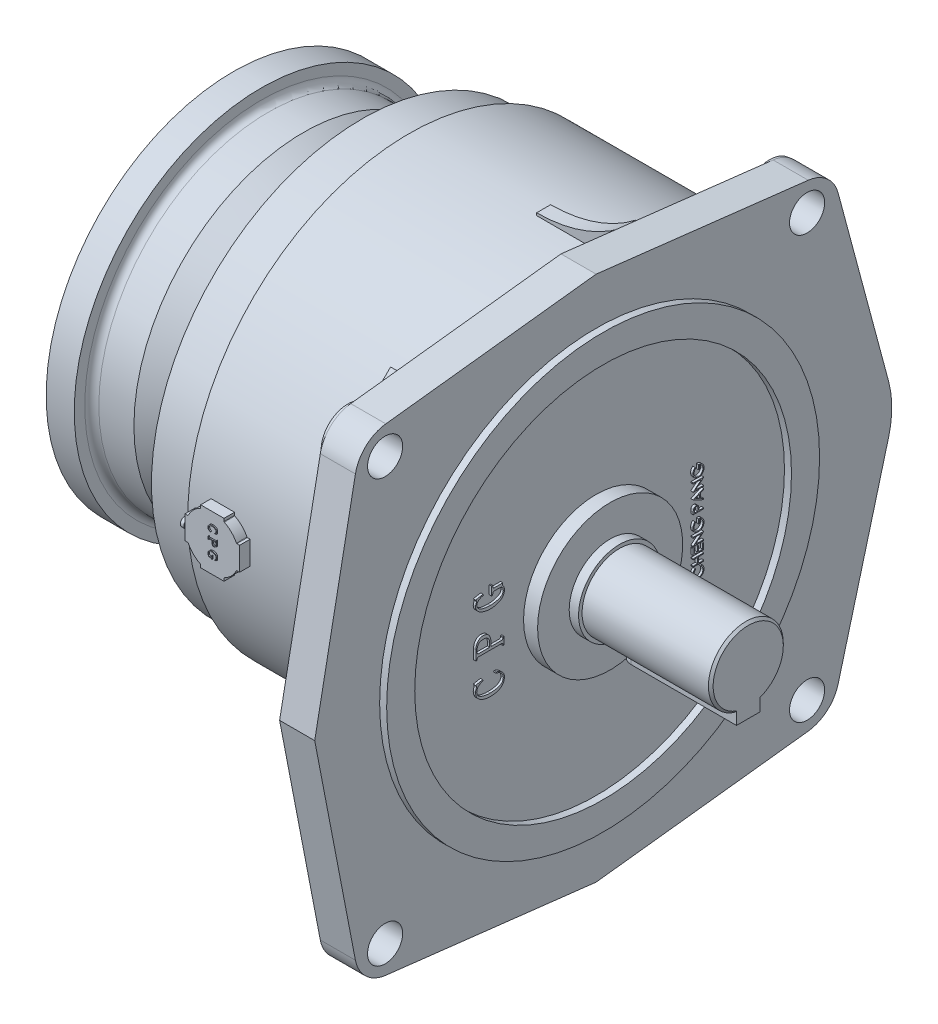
SolidWorks part; units mm, degrees
ref_plane "前视基准面" through (0, 0, 0) normal (0, 0, 1) x (1, 0, 0)
ref_plane "上视基准面" through (0, 0, 0) normal (0, 1, 0) x (1, 0, 0)
ref_plane "右视基准面" through (0, 0, 0) normal (1, 0, 0) x (0, 0, -1)
sketch "草图1" plane through (0, 0, 0) normal (0, 1, 0) x (1, 0, 0)
  line L0 (0, 0) -> (15.7361, 0) construction
  line L1 (0, 0) -> (0, -16)
  line L2 (0, -16) -> (-55, -16)
  line L3 (-55, -16) -> (-55, -17.5)
  line L4 (-55, -17.5) -> (-59, -17.5)
  line L5 (-62, -31) -> (-62, -92.5)
  line L6 (-62, -92.5) -> (-65, -92.5)
  line L7 (-65, -92.5) -> (-65, 0)
  line L8 (-65, 0) -> (0, 0)
  line L9 (-62, -31) -> (-59, -31)
  line L10 (-59, -31) -> (-59, -17.5)
  dimension "D1" = 55
  dimension "D2" = 32
  dimension "D3" = 35
  dimension "D4" = 3
  dimension "D5" = 185
  dimension "D6" = 65
  dimension "D7" = 3
  dimension "D8" = 62
revolve "旋转1" add sketch "草图1" angle 360 about L0
sketch "草图2" plane through (0, 0, 0) normal (0, 1, 0) x (1, 0, 0)
  line L0 (8.0167, 30) -> (-80, 30) construction
  line L1 (-65, 92.5) -> (-65, -92.5) construction
  line L4 (-80, 30) -> (-80, -64.5)
  line L5 (-80, -64.5) -> (-175, -64.5)
  line L6 (-175, -64.5) -> (-175, 30)
  line L11 (-80, 30) -> (-175, 30)
  dimension "D1" = 30
  dimension "D2" = 15
  dimension "D3" = 189
  dimension "D5" = 95
revolve "旋转2" add sketch "草图2" angle 360 about L0
sketch "草图12" plane through (-80, 0, 0) normal (1, 0, 0) x (0, 0, -1)
  line L0 (0, -112.5) -> (100.7627, -100.7627)
  line L1 (-100.7627, -100.7627) -> (0, -112.5)
  line L2 (-100.7627, -100.7627) -> (-120.238, 0)
  line L3 (-100.7627, 100.7627) -> (0, 112.5)
  line L4 (100.7627, -100.7627) -> (127.762, 0)
  line L5 (-120.238, 0) -> (-100.7627, 100.7627)
  line L6 (0, 112.5) -> (100.7627, 100.7627)
  line L7 (127.762, 0) -> (100.7627, 100.7627)
  line L8 (167.8979, 0) -> (-107.2143, 0) construction
  line L9 (0, 107.5085) -> (0, -103.3164) construction
  line L10 (0, 0) -> (-90.1561, 90.1561) construction
  line L11 (0, 0) -> (90.1561, 90.1561) construction
  circle A0 centre (0, 0) radius 127.5 construction
  circle A1 centre (-90.1561, 90.1561) radius 7.5
  circle A2 centre (90.1561, 90.1561) radius 7.5
  circle A3 centre (90.1561, -90.1561) radius 7.5
  circle A4 centre (-90.1561, -90.1561) radius 7.5
  dimension "D3" = 255
  dimension "D4" = 15
  dimension "D5" = 15
  dimension "D1" = 225
  dimension "D2" = 248
  dimension "D6" = 15
extrude "拉伸8" add sketch "草图12" along normal up to surface (15 mm away)
sketch "草图5" plane through (0, 0, 0) normal (0, 1, 0) x (1, 0, 0)
  line L0 (0, -5) -> (-45, -5)
  line L1 (0, -16) -> (0, 16) construction
  line L2 (-45, 5) -> (0, 5)
  line L3 (0, 5) -> (0, -5)
  line L4 (35.5, -13.7955) -> (35.5, 19.6443) construction
  arc A0 (-45, -5) -> (-45, 5) centre (-45, 0) cw
  dimension "D2" = 50
  dimension "D1" = 10
  dimension "D3" = 35.5
extrude "拉伸4" add sketch "草图5" against normal blind 19.5
fillet "圆角4" radius 15 4 edges at (-72.5, 100.7627, 100.7627) (-72.5, 100.7627, -100.7627) (-72.5, -100.7627, -100.7627) (-72.5, -100.7627, 100.7627)
fillet "圆角5" radius 40 1 edges at (-72.5, 0, -127.762)
chamfer "倒角1" distance 1 angle 45 1 edges at (0, 16, 0)
sketch "草图18" plane through (-80, 0, 0) normal (-1, 0, 0) x (0, 0, 1)
  line L0 (-30, 0) -> (73.8927, -103.8927) construction
  line L1 (0, -96.25) -> (0, 96.25) construction
  line L2 (89.8548, -102.0333) -> (0, -112.5) construction
  line L3 (36.8216, -66.8216) -> (73.8927, -103.8927)
  line L4 (-30, 0) -> (-90.1561, -90.1561) construction
  line L5 (-88.91, -87.0419) -> (-82.4506, -78.6078)
  line L7 (-30, 0) -> (-30, -109.0055) construction
  line L8 (0, -112.5) -> (-90.6456, -101.9412) construction
  line L9 (-30, -94.5) -> (-30, -109.0055)
  circle A0 centre (-30, 0) radius 94.5 construction
  arc A1 (-103.3989, -90.9242) -> (-90.6456, -101.9412) centre (-88.91, -87.0419) ccw construction
  circle A3 centre (-30, 0) radius 94.5 construction
  dimension "D1" = 45
  dimension "D2" = 10.6235
  dimension "D4" = 52.4264
  dimension "D5" = 14.5055
ref_plane "基准面7" through (-81, 0, 0) normal (1, 0, 0) x (0, 0, -1)
sketch "草图13" plane through (-80, 0, 0) normal (1, 0, 0) x (0, 0, -1)
  line L5 (0, 0) -> (107.7406, 0) construction
  circle A1 centre (90.1561, 90.1561) radius 11.6458
  circle A3 centre (90.1561, 90.1561) radius 7.5
  circle A4 centre (90.1561, -90.1561) radius 7.5 construction
  circle A5 centre (90.1561, -90.1561) radius 7.5
  circle A7 centre (-90.1561, -90.1561) radius 7.5
  arc A10 (90.6456, -101.9412) -> (103.3989, -90.9242) centre (88.91, -87.0419) ccw construction
  circle A11 centre (-90.1561, -90.1561) radius 7.5 construction
  arc A12 (-102.8467, -89.9806) -> (-89.8548, -102.0333) centre (-88.1192, -87.1341) ccw construction
  circle A14 centre (-90.1561, 90.1561) radius 7.5
  circle A15 centre (-90.1561, 90.1561) radius 11.3556
  circle A20 centre (-90.1561, -90.1561) radius 11.3556
  circle A21 centre (90.1561, -90.1561) radius 11.6458
  point P8 (30, 0)
extrude "拉伸9" add sketch "草图13" against normal up to surface (1 mm away)
sketch "草图14" plane through (0, 0, 0) normal (0, 1, 0) x (1, 0, 0)
  line L0 (-80, 30) -> (-175, 30) construction
  line L5 (-80, -89.8548) -> (-80, 0) construction
  line L6 (-117.4264, -64.5) -> (-117.4264, -65.5)
  line L7 (-80, -101.9264) -> (-81, -101.9264)
  line L9 (-80, -64.5) -> (-175, -64.5) construction
  arc A0 (-81, -101.9264) -> (-117.4264, -65.5) centre (-117.4264, -101.9264) ccw
  dimension "D1" = 131.9264
  dimension "D2" = 1
  dimension "D3" = 1
rib "筋17" sketch "草图14" sketch "草图14" thickness 6 extrusion direction parallel to sketch draft on no parameters "D1"=6
pattern_circular "阵列(圆周)16" count 8 over 360 about axis through (0, 0, -30) along (1, 0, 0) of "筋17"
ref_plane "基准面8" through (0, 0, -30) normal (0, 0, 1) x (1, 0, 0)
sketch "草图17" plane through (0, 0, -30) normal (0, 0, 1) x (1, 0, 0)
  line L0 (-80, -108.0055) -> (-81, -108.0055)
  line L1 (-80, -102.0333) -> (-80, -112.5) construction
  line L2 (-117.4264, -94.5) -> (-117.4264, -95.5)
  line L4 (-175, -94.5) -> (-80, -94.5) construction
  line L6 (-117.4264, -69.65) -> (-117.4264, -65.4074) construction
  arc A0 (-81, -108.0055) -> (-117.4264, -95.5) centre (-117.4264, -154.8049) ccw
  dimension "D1" = 13.5055
  dimension "D2" = 1
  dimension "D3" = 1
rib "筋24" sketch "草图17" sketch "草图17" thickness 6 extrusion direction parallel to sketch draft on no parameters "D1"=6
mirror "镜向1" about plane through (0, 0, 0) normal (0, 1, 0) of "筋24"
sketch "草圖1" plane through (0, 0, 0) normal (0, 1, 0) x (1, 0, 0)
  line L0 (-175, 30) -> (-242.5, 30)
  line L1 (-175, 124.5) -> (-175, -64.5) construction
  line L2 (-37.3334, 30) -> (-347.0809, 30) construction
  line L3 (-195, -60) -> (-195, -30)
  line L4 (-195, -30) -> (-200, -30)
  line L5 (-200, -30) -> (-220, -42.5)
  line L6 (-220, -42.5) -> (-235, -42.5)
  line L7 (-238, -45.5) -> (-238, -50)
  line L8 (-238, -50) -> (-250, -50)
  line L9 (-250, -50) -> (-250, -26)
  line L10 (-249, -25) -> (-246, -25)
  line L11 (-246, -25) -> (-246, -20.0871)
  line L12 (-225, -9.5606) -> (-225, -4)
  line L13 (-228, -1) -> (-243, -1)
  line L14 (-244, 0) -> (-244, 9)
  line L15 (-244, 9) -> (-242.8, 9)
  line L16 (-242.5, 9.3) -> (-242.5, 30)
  line L17 (-245.9137, -19.988) -> (-225, -17.0869)
  line L18 (-195, -60) -> (-175, -60)
  line L19 (-175, 30) -> (-175, -60)
  arc A0 (-235, -42.5) -> (-238, -45.5) centre (-235, -45.5) ccw
  arc A1 (-225, -17.0869) -> (-223.7461, -12.0001) centre (-225.3875, -14.2934) ccw
  arc A2 (-249, -25) -> (-250, -26) centre (-249, -26) ccw
  arc A3 (-245.9137, -19.988) -> (-246, -20.0871) centre (-245.9, -20.0871) ccw
  arc A4 (-223.7461, -12.0001) -> (-225, -9.5606) centre (-222, -9.5606) cw
  arc A5 (-225, -4) -> (-228, -1) centre (-228, -4) ccw
  arc A6 (-243, -1) -> (-244, 0) centre (-243, 0) cw
  arc A7 (-242.8, 9) -> (-242.5, 9.3) centre (-242.8, 9.3) ccw
  point P27 (-250, -25)
  point P30 (-246, -20)
  point P33 (-225, -11.5)
  point P38 (-244, -1)
  point P41 (-244, 10)
  dimension "D9" = 160
  dimension "D19" = 30
  dimension "D2" = 180
  dimension "D3" = 55
  dimension "D4" = 250
  dimension "D5" = 195
  dimension "D8" = 145
  dimension "D10" = 110
revolve "旋轉1" add sketch "草圖1" angle 360 about L2
sketch "草圖2" plane through (-250, 0, 0) normal (-1, 0, 0) x (0, 0, 1)
  line L0 (-114.0945, 0) -> (58.8288, 0) construction
  line L1 (-30, 84.2191) -> (-30, -84.9666) construction
  circle A0 centre (-30, 0) radius 65 construction
  circle A1 centre (-75.9619, 45.9619) radius 4
  circle A2 centre (15.9619, 45.9619) radius 4
  circle A3 centre (15.9619, -45.9619) radius 4
  circle A4 centre (-75.9619, -45.9619) radius 4
  dimension "D1" = 130
  dimension "D2" = 8
extrude "伸長1" cut sketch "草圖2" against normal blind 25
sketch "草圖3" plane through (-250, 0, 0) normal (-1, 0, 0) x (0, 0, 1)
  line L0 (-29.7357, 0.1095) -> (-95.9995, 0.1095) construction
  line L1 (-90.8691, 25.8875) -> (-71.1652, 5.6346)
  line L2 (-90.8691, -25.14) -> (-71.1013, -5.3652)
  line L3 (-70.1598, 10.8351) -> (-77.2309, 17.9061)
  line L4 (-47.5324, 47.6046) -> (-40.4613, 40.5336)
  line L5 (-76.4923, 35.1988) -> (-64.825, 46.866)
  line L6 (-55.5138, 61.2429) -> (-35.739, 41.475)
  line L7 (-4.4862, 61.2429) -> (-24.7392, 41.539)
  line L8 (4.825, 46.866) -> (16.4923, 35.1988)
  line L10 (17.2309, 17.9061) -> (10.1598, 10.8351)
  line L11 (30.8691, 25.8875) -> (11.1013, 6.1127)
  line L12 (30.8691, -25.14) -> (11.1652, -4.8871)
  line L13 (16.4923, -34.4513) -> (4.825, -46.1185)
  line L15 (-12.4676, -46.8571) -> (-19.5387, -39.7861)
  line L16 (-4.4862, -60.4954) -> (-24.261, -40.7275)
  line L17 (-55.5138, -60.4954) -> (-35.2608, -40.7914)
  line L18 (-64.825, -46.1185) -> (-76.4923, -34.4513)
  line L20 (-77.2309, -17.1586) -> (-70.1598, -10.0876)
  line L22 (-19.5387, 40.5336) -> (-12.4676, 47.6046)
  line L24 (10.1598, -10.0876) -> (17.2309, -17.1586)
  line L29 (-40.4613, -39.7861) -> (-47.5324, -46.8571)
  arc A0 (-90.8691, 25.8875) -> (-90.8691, -25.14) centre (-30, 0.3738) ccw
  arc A1 (-40.4613, 40.5336) -> (-70.1598, 10.8351) centre (-30, 0.3738) ccw
  arc A2 (10.1598, 10.8351) -> (-19.5387, 40.5336) centre (-30, 0.3738) ccw
  arc A3 (-71.1652, 5.6346) -> (-71.1013, -5.3652) centre (-30, 0.3738) ccw
  arc A4 (-4.4862, 61.2429) -> (-55.5138, 61.2429) centre (-30, 0.3738) ccw
  arc A5 (-24.7392, 41.539) -> (-35.739, 41.475) centre (-30, 0.3738) ccw
  arc A6 (-19.5387, -39.7861) -> (10.1598, -10.0876) centre (-30, 0.3738) ccw
  arc A7 (30.8691, -25.14) -> (30.8691, 25.8875) centre (-30, 0.3738) ccw
  arc A8 (11.1652, -4.8871) -> (11.1013, 6.1127) centre (-30, 0.3738) ccw
  arc A9 (-70.1598, -10.0876) -> (-40.4613, -39.7861) centre (-30, 0.3738) ccw
  arc A10 (-55.5138, -60.4954) -> (-4.4862, -60.4954) centre (-30, 0.3738) ccw
  arc A11 (-35.2608, -40.7914) -> (-24.261, -40.7275) centre (-30, 0.3738) ccw
  spline S0 degree 2 poles (-77.2309, 17.9061) (-82.0713, 26.7678) (-76.4923, 35.1988) knots 0 0 0 1 1 1
  spline S1 degree 2 poles (-47.5324, 47.6046) (-56.3941, 52.445) (-64.825, 46.866) knots 0 0 0 1 1 1
  spline S2 degree 2 poles (17.2309, 17.9061) (22.0713, 26.7678) (16.4923, 35.1988) knots 0 0 0 1 1 1
  spline S3 degree 2 poles (-12.4676, 47.6046) (-3.6059, 52.445) (4.825, 46.866) knots 0 0 0 1 1 1
  spline S4 degree 2 poles (-12.4676, -46.8571) (-3.6059, -51.6975) (4.825, -46.1185) knots 0 0 0 1 1 1
  spline S5 degree 2 poles (17.2309, -17.1586) (22.0713, -26.0203) (16.4923, -34.4513) knots 0 0 0 1 1 1
  spline S6 degree 2 poles (-77.2309, -17.1586) (-82.0713, -26.0203) (-76.4923, -34.4513) knots 0 0 0 1 1 1
  spline S7 degree 2 poles (-47.5324, -46.8571) (-56.3941, -51.6975) (-64.825, -46.1185) knots 0 0 0 1 1 1
extrude "伸長2" cut sketch "草圖3" against normal blind 39
sketch "草圖4" plane through (-211, 0, 0) normal (-1, 0, 0) x (0, 0, 1)
  circle A0 centre (-30, 0) radius 51.5 construction
  circle A1 centre (-66.416, 36.416) radius 3
  circle A2 centre (6.416, 36.416) radius 3
  circle A3 centre (6.416, -36.416) radius 3
  circle A4 centre (-66.416, -36.416) radius 3
  dimension "D1" = 103
  dimension "D2" = 6
extrude "伸長3" cut sketch "草圖4" against normal blind 11
sketch "草圖5" plane through (-242.5, 0, 0) normal (-1, 0, 0) x (0, 0, 1)
  line L0 (-46.5253, 0) -> (-14, 0) construction
  line L1 (-32.5, -9.3) -> (-27.5, -9.3)
  line L2 (-32.5, -9.3) -> (-32.5, -6.5383)
  line L3 (-30, 17.7414) -> (-30, -16.5842) construction
  line L4 (-27.5, -9.3) -> (-27.5, -6.5383)
  circle A0 centre (-30, 0) radius 12.5 construction
  arc A2 (-27.5, -6.5383) -> (-32.5, -6.5383) centre (-30, 0) ccw
  dimension "D1" = 25
  dimension "D2" = 5
  dimension "D5" = 14
  dimension "D4" = 9.3
extrude "伸長4" cut sketch "草圖5" against normal blind 28
sketch "草圖6" plane through (-242.5, 0, 0) normal (-1, 0, 0) x (0, 0, 1)
  line L0 (-32.5, -9.3) -> (-32.5, -6.5383) construction
  line L1 (-32.5, -9.3) -> (-27.5, -9.3) construction
  line L2 (-27.5, -9.3) -> (-27.5, -6.5383) construction
  line L3 (-32.5, -9.3) -> (-32.5, -6.5383)
  line L4 (-32.5, -9.3) -> (-27.5, -9.3)
  line L5 (-27.5, -9.3) -> (-27.5, -6.5383)
  arc A0 (-27.5, -6.5383) -> (-32.5, -6.5383) centre (-30, 0) ccw construction
  arc A1 (-27.5, -6.5383) -> (-32.5, -6.5383) centre (-30, 0) ccw
  circle A2 centre (-30, 0) radius 12.5 construction
  circle A3 centre (-30, 0) radius 12.5
extrude "伸長5" add sketch "草圖6" along normal blind 1
sketch "草圖7" plane through (-62, 0, 0) normal (1, 0, 0) x (0, 0, -1)
  circle A0 centre (0, 0) radius 80.5
  circle A1 centre (0, 0) radius 31 construction
  circle A2 centre (0, 0) radius 31
  dimension "D1" = 161
extrude "伸長6" cut sketch "草圖7" against normal blind 3
sketch "草圖8"
  dimension "D1" = 70
  dimension "D2" = 70
  dimension "D3" = 40
  dimension "D4" = 45
  dimension "D5" = 35
extrude "伸長7" add sketch "草圖8" along normal blind 1
ref_plane "平面1" through (0, 0, 69) normal (0, 0, 1) x (1, 0, 0)
sketch "草圖9" plane through (0, 0, 69) normal (0, 0, 1) x (1, 0, 0)
  line L0 (-165, 11.65) -> (-155, 11.65)
  line L1 (-165, 11.65) -> (-165, 10.5119)
  line L2 (-155, 11.65) -> (-155, 10.5119)
  line L3 (-165, -10.5119) -> (-165, -11.65)
  line L4 (-155, -10.5119) -> (-155, -11.65)
  line L5 (-171.65, 5) -> (-170.5119, 5)
  line L6 (-171.65, -5) -> (-170.5119, -5)
  line L7 (-171.65, -5) -> (-171.65, 5)
  line L8 (-165, -11.65) -> (-165, -10.5119)
  line L9 (-155, -11.65) -> (-155, -10.5119)
  line L10 (-155, -11.65) -> (-165, -11.65)
  line L11 (-148.35, -5) -> (-149.4881, -5)
  line L12 (-148.35, 5) -> (-149.4881, 5)
  line L13 (-148.35, 5) -> (-148.35, -5)
  arc A0 (-165.1383, 10.2882) -> (-170.2882, 5.1383) centre (-160, 0) ccw
  arc A1 (-165.1383, 10.2882) -> (-165, 10.5119) centre (-165.25, 10.5119) ccw
  arc A2 (-155, 10.5119) -> (-154.8617, 10.2882) centre (-154.75, 10.5119) ccw
  arc A3 (-170.5119, 5) -> (-170.2882, 5.1383) centre (-170.5119, 5.25) ccw
  arc A4 (-170.2882, -5.1383) -> (-170.5119, -5) centre (-170.5119, -5.25) ccw
  arc A5 (-165, -10.5119) -> (-165.1383, -10.2882) centre (-165.25, -10.5119) ccw
  arc A6 (-154.8617, -10.2882) -> (-155, -10.5119) centre (-154.75, -10.5119) ccw
  arc A7 (-149.4881, -5) -> (-149.7118, -5.1383) centre (-149.4881, -5.25) ccw
  arc A8 (-149.7118, 5.1383) -> (-149.4881, 5) centre (-149.4881, 5.25) ccw
  arc A9 (-149.7118, 5.1383) -> (-154.8617, 10.2882) centre (-160, 0) ccw
  arc A10 (-170.2882, -5.1383) -> (-165.1383, -10.2882) centre (-160, 0) ccw
  arc A11 (-154.8617, -10.2882) -> (-149.7118, -5.1383) centre (-160, 0) ccw
extrude "伸長8" add sketch "草圖9" against normal blind 4.5 separate body contours A6 A11 A7 L11 L13 L12 A8 A9 A2 L2 L0 L1 A1 A0 A3 L5 L7 L6 A4 A10 A5 L3 L10 L4
sketch "草圖10"
extrude "伸長9" add sketch "草圖10" along normal blind 0.5
sketch "草圖11" plane through (0, 0, 0) normal (0, 1, 0) x (1, 0, 0)
  line L0 (-173.8855, -66.75) -> (-165.8855, -66.75)
  line L1 (-173.8855, -66.75) -> (-173.8855, -64.75)
  line L2 (-172.3855, -65.5) -> (-172.3855, -64.75)
  line L3 (-123.75, -69) -> (123.75, -69) construction
  line L13 (-170.3855, -65.5) -> (-165.8855, -65.75)
  line L15 (-172.3855, -65.5) -> (-170.3855, -65.5)
  line L23 (-173.8855, -64.75) -> (-172.3855, -64.75)
  line L24 (-170.3855, -66.75) -> (-170.3855, -65.5)
  line L25 (-165.8855, -66.75) -> (-165.8855, -65.75)
  dimension "D1" = 2.25
revolve "旋轉2" add sketch "草圖11" angle 360 about L0
equation "\"D5@草图1\" = \"D1@草圖7\"+24"
equation "\"D3@草图1\" = \"D2@草图1\"+3"
equation "\"D1@拉伸4\" = \"D3@草图5\"-\"D2@草图1\"/2"
equation "\"D3@草圖1\" = \"D4@草圖1\"-\"D5@草圖1\""
